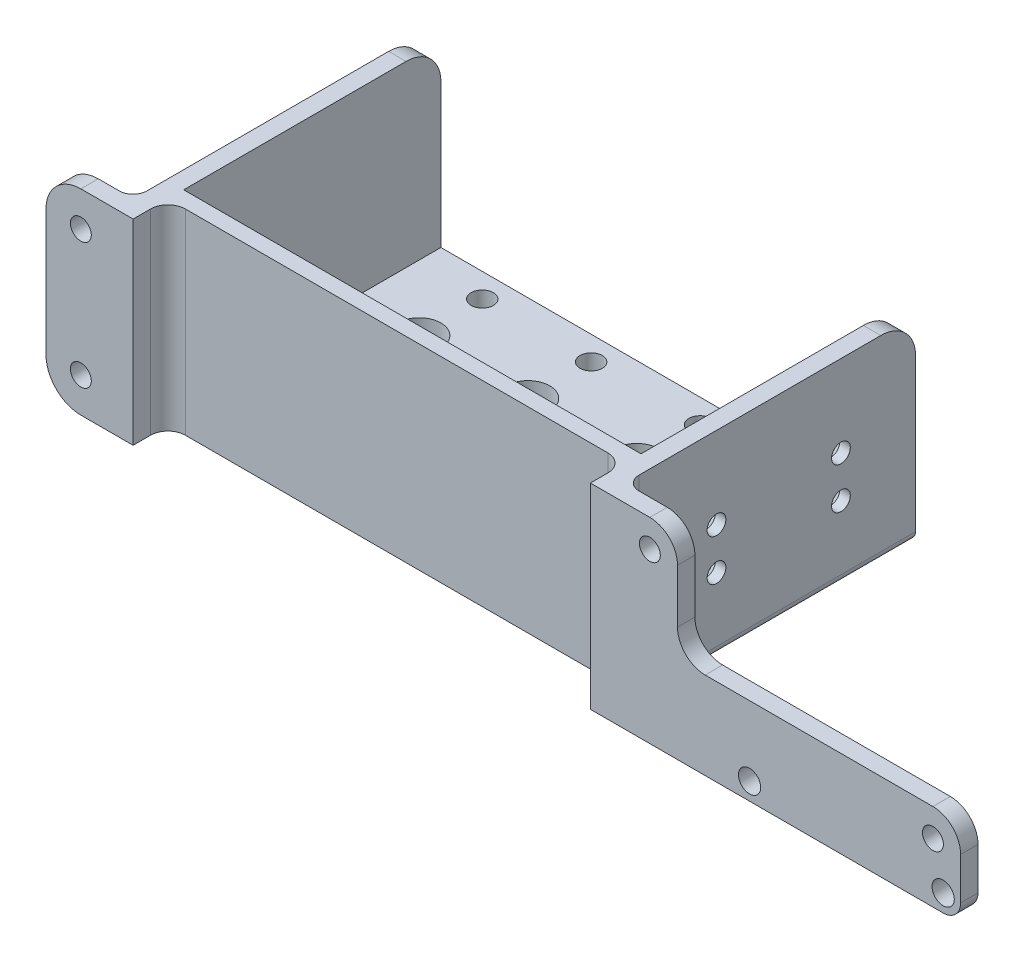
SolidWorks part; units mm, degrees
ref_plane "Front" through (0, 0, 0) normal (0, 0, 1) x (1, 0, 0)
ref_plane "Top" through (0, 0, 0) normal (0, 1, 0) x (1, 0, 0)
ref_plane "Right" through (0, 0, 0) normal (1, 0, 0) x (0, 0, -1)
sketch "Sketch1" plane through (0, 0, 0) normal (0, 1, 0) x (1, 0, 0)
  line L1 (-52.5, 0) -> (52.5, 0)
  line L2 (-52.5, 0) -> (-52.5, 66.675)
  line L3 (-52.5, 66.675) -> (52.5, 66.675)
  line L4 (52.5, 0) -> (52.5, 66.675)
  point P6 (0, 0)
  dimension "D1" = 66.675
  dimension "D2" = 105
extrude "Boss-Extrude1" add sketch "Sketch1" along normal blind 4
sketch "Sketch2" plane through (0, 4, 0) normal (0, 1, 0) x (1, 0, 0)
  line L0 (-52.5, 66.675) -> (-52.5, 0) construction
  line L5 (-37.5, 46.675) -> (-37.5, 28.675) construction
  line L6 (-32.5, 46.675) -> (-32.5, 28.675)
  line L7 (-42.5, 46.675) -> (-42.5, 28.675)
  line L8 (52.5, 66.675) -> (-52.5, 66.675) construction
  arc A4 (-32.5, 46.675) -> (-42.5, 46.675) centre (-37.5, 46.675) ccw
  arc A5 (-42.5, 28.675) -> (-32.5, 28.675) centre (-37.5, 28.675) ccw
  point P22 (-37.5, 37.675)
  dimension "D4" = 29
  dimension "D3" = 5
  dimension "D1" = 15
  dimension "D2" = 18
extrude "Cut-Extrude1" cut sketch "Sketch2" against normal through all
hole_wizard "#7 (0.201) Diameter Hole1" positions "Sketch51" profile "Sketch4" hole size "#7" standard "ANSI Inch"
sketch "Sketch51" plane through (0, 4, 0) normal (0, 1, 0) x (1, 0, 0)
  line L0 (-37.5, 61.175) -> (-37.5, 14.175)
  line L10 (-32.5, 28.675) -> (-32.5, 46.675) construction
  arc A0 (-32.5, 46.675) -> (-42.5, 46.675) centre (-37.5, 46.675) ccw construction
  point P0 (-37.5, 61.175)
  point P2 (-37.5, 14.175)
  point P24 (-37.5, 51.675)
  point P41 (-32.5, 37.675)
  point P42 (-37.5, 37.675)
  dimension "D1" = 47
sketch "Sketch4" plane through (-37.5, 4, -61.175) normal (1, 0, 0) x (0, 0, 1)
  line L0 (0, 0) -> (0, 4)
  line L1 (0, 4) -> (2.5527, 4)
  line L2 (2.5527, 4) -> (2.5527, 0)
  line L5 (2.5527, 0) -> (0, 0)
  line L11 (0, -6.35) -> (0, 107.95) construction
  dimension "Thru Hole Dia." = 5.1054
  dimension "Thru Hole Depth" = 4
hole_wizard "CSK for #6 Flat Head Machine Screw1" positions "Sketch52" profile "Sketch19" countersink size "#6" standard "ANSI Inch"
sketch "Sketch52" plane through (0, 0, 0) normal (0, -1, 0) x (-1, 0, 0)
  line L0 (32.7375, 56.095) -> (42.2625, 56.095)
  line L2 (37.5, 51.675) -> (37.5, 23.675)
  line L6 (42.2625, 19.255) -> (32.7375, 19.255)
  arc A0 (32.5, 28.675) -> (42.5, 28.675) centre (37.5, 28.675) ccw construction
  arc A1 (42.5, 46.675) -> (32.5, 46.675) centre (37.5, 46.675) ccw construction
  point P0 (32.7375, 56.095)
  point P2 (42.2625, 56.095)
  point P17 (37.5, 56.095)
  point P31 (42.2625, 19.255)
  point P33 (32.7375, 19.255)
  point P42 (37.5, 19.255)
  dimension "D1" = 9.525
  dimension "D2" = 5.08
  dimension "D3" = 5.08
sketch "Sketch19" plane through (-32.7375, 0, -56.095) normal (1, 0, 0) x (0, 0, -1)
  line L0 (0, 0) -> (0, 4)
  line L1 (0, 4) -> (2.1526, 4)
  line L2 (2.1526, 4) -> (2.1526, 1.5998)
  line L3 (2.1526, 1.5998) -> (3.5433, 0)
  line L5 (3.5433, 0) -> (0, 0)
  line L6 (-2.1526, 1.5998) -> (-3.5433, 0) construction
  line L11 (0, -6.35) -> (0, 107.95) construction
  dimension "Thru Hole Dia." = 4.3053
  dimension "Thru Hole Depth" = 4
  dimension "Near C'Sink Dia." = 7.0866
  dimension "Near C'Sink Angle" = 82
pattern_linear "LPattern1" count 4 spacing 25 along (1, 0, 0) of "Cut-Extrude1", "#7 (0.201) Diameter Hole1", "CSK for #6 Flat Head Machine Screw1"
sketch "Sketch7" plane through (0, 0, 0) normal (0, 0, 1) x (1, 0, 0)
  line L1 (-72.5, 0) -> (52.5, 0)
  line L2 (-72.5, 0) -> (-72.5, 45)
  line L3 (-72.5, 45) -> (72.5, 45)
  line L5 (-52.5, 4) -> (-52.5, 0) construction
  line L9 (52.5, 0) -> (137.5, 0)
  line L10 (137.5, 20) -> (137.5, 0)
  line L11 (52.5, 4) -> (52.5, 0) construction
  line L13 (137.5, 20) -> (72.5, 20)
  line L14 (72.5, 45) -> (72.5, 20)
  point P11 (52.5, 2)
  dimension "D1" = 85
  dimension "D2" = 20
  dimension "D3" = 45
  dimension "D4" = 20
  dimension "D5" = 20
extrude "Boss-Extrude2" add sketch "Sketch7" along normal blind 4
fillet "Fillet1" radius 8 2 edges at (-72.5, 0, 2) (-72.5, 45, 2)
fillet "Fillet2" radius 4 1 edges at (137.5, 0, 2)
sketch "Sketch8" plane through (52.5, 0, 0) normal (1, 0, 0) x (0, 0, -1)
  line L0 (0, 45) -> (58.675, 45)
  line L1 (66.675, 37) -> (66.675, 0)
  line L3 (0, 0) -> (66.675, 0) construction
  line L4 (66.675, 0) -> (0, 0)
  line L5 (0, 0) -> (0, 45)
  line L7 (66.675, 4) -> (66.675, 0) construction
  arc A0 (58.675, 45) -> (66.675, 37) centre (58.675, 37) cw
  dimension "D1" = 8
extrude "Boss-Extrude3" add sketch "Sketch8" along normal blind 4
mirror "Mirror1" about plane through (0, 0, 0) normal (1, 0, 0) of "Boss-Extrude3"
fillet "Fillet6" radius 6.35 3 edges at (137.5, 20, 2) (72.5, 45, 2) (72.5, 20, 2)
hole_wizard "M4 Clearance Hole1" positions "Sketch55" profile "Sketch10" hole size "M4" standard "ANSI Metric"
sketch "Sketch55" plane through (0, 0, 0) normal (0, 0, -1) x (-1, 0, 0)
  point P0 (-66.15, 38.65)
  point P3 (-131.15, 13.65)
  point P6 (64.5, 37)
  point P9 (64.5, 8)
  point P47 (0, 0)
  point P48 (-66.15, 38.65)
  point P50 (0, 0)
  point P51 (-131.15, 13.65)
sketch "Sketch10" plane through (66.15, 38.65, 0) normal (1, 0, 0) x (0, 1, 0)
  line L0 (0, 0) -> (0, 4)
  line L1 (0, 4) -> (2.4, 4)
  line L2 (2.4, 4) -> (2.4, 0)
  line L5 (2.4, 0) -> (0, 0)
  line L11 (0, -6.35) -> (0, 107.95) construction
  dimension "Thru Hole Dia." = 4.8
  dimension "Thru Hole Depth" = 4
hole_wizard "#7 (0.201) Diameter Hole2" positions "Sketch56" profile "Sketch30" hole size "#7" standard "ANSI Inch"
sketch "Sketch56" plane through (0, 0, 0) normal (0, 0, -1) x (-1, 0, 0)
  point P0 (-133.5, 4)
  point P3 (-89.05, 4)
  point P48 (-133.5, 4)
  point P50 (0, 0)
  point P51 (-133.5, 4)
  dimension "D1" = 44.45
sketch "Sketch30" plane through (133.5, 4, 0) normal (1, 0, 0) x (0, 1, 0)
  line L0 (0, 0) -> (0, 4)
  line L1 (0, 4) -> (2.5527, 4)
  line L2 (2.5527, 4) -> (2.5527, 0)
  line L5 (2.5527, 0) -> (0, 0)
  line L11 (0, -6.35) -> (0, 107.95) construction
  dimension "Thru Hole Dia." = 5.1054
  dimension "Thru Hole Depth" = 4
hole_wizard "CSK for #6 Flat Head Machine Screw2" positions "Sketch54" profile "Sketch38" countersink size "#6" standard "ANSI Inch"
sketch "Sketch54" plane through (52.5, 0, 0) normal (-1, 0, 0) x (0, 0, 1)
  line L1 (-49.53, 26.225) -> (-20.955, 26.225)
  line L2 (-49.53, 26.225) -> (-49.53, 16.7)
  line L3 (-49.53, 16.7) -> (-20.955, 16.7)
  line L4 (-20.955, 26.225) -> (-20.955, 16.7)
  line L5 (-66.675, 4) -> (-66.675, 37) construction
  line L6 (0, 4) -> (-66.675, 4) construction
  dimension "D1" = 9.525
  dimension "D2" = 28.575
  dimension "D3" = 17.145
  dimension "D4" = 12.7
sketch "Sketch38" plane through (52.5, 26.225, -49.53) normal (0, 1, 0) x (0, 0, 1)
  line L0 (0, 0) -> (0, 85)
  line L1 (0, 85) -> (2.1526, 85)
  line L2 (2.1526, 85) -> (2.1526, 1.5998)
  line L3 (2.1526, 1.5998) -> (3.5433, 0)
  line L5 (3.5433, 0) -> (0, 0)
  line L6 (-2.1526, 1.5998) -> (-3.5433, 0) construction
  line L11 (0, -6.35) -> (0, 107.95) construction
  dimension "Thru Hole Dia." = 4.3053
  dimension "Thru Hole Depth" = 85
  dimension "Near C'Sink Dia." = 7.0866
  dimension "Near C'Sink Angle" = 82
other "Move Face1" parameters "D1"=7.62
sketch "Sketch43" plane through (0, 0, 0) normal (0, -1, 0) x (1, 0, 0)
  line L0 (-64.5, 4) -> (133.5, 4) construction
  line L1 (-52.5, 4) -> (52.5, 4)
  line L2 (-52.5, 4) -> (-52.5, -4)
  line L3 (-52.5, -4) -> (52.5, -4)
  line L4 (52.5, 4) -> (52.5, -4)
  line L5 (-56.5, 0) -> (-56.5, -66.675) construction
  line L7 (56.5, 0) -> (56.5, -66.675) construction
  dimension "D1" = 8
  dimension "D2" = 4
  dimension "D3" = 4
extrude "Cut-Extrude3" cut sketch "Sketch43" against normal through all
fillet "Fillet3" radius 4 2 edges at (52.5, 22.5, -4) (-52.5, 22.5, -4)
fillet "Fillet7" radius 2 2 edges at (-56.5, 0, -33.3375) (56.5, 0, -33.3375)
fillet "Fillet5" radius 3.175 4 edges at (-56.5, 23.5, 0) (56.5, 23.5, 0) (-55.9142, 0.5858, 0) (55.9142, 0.5858, 0)
